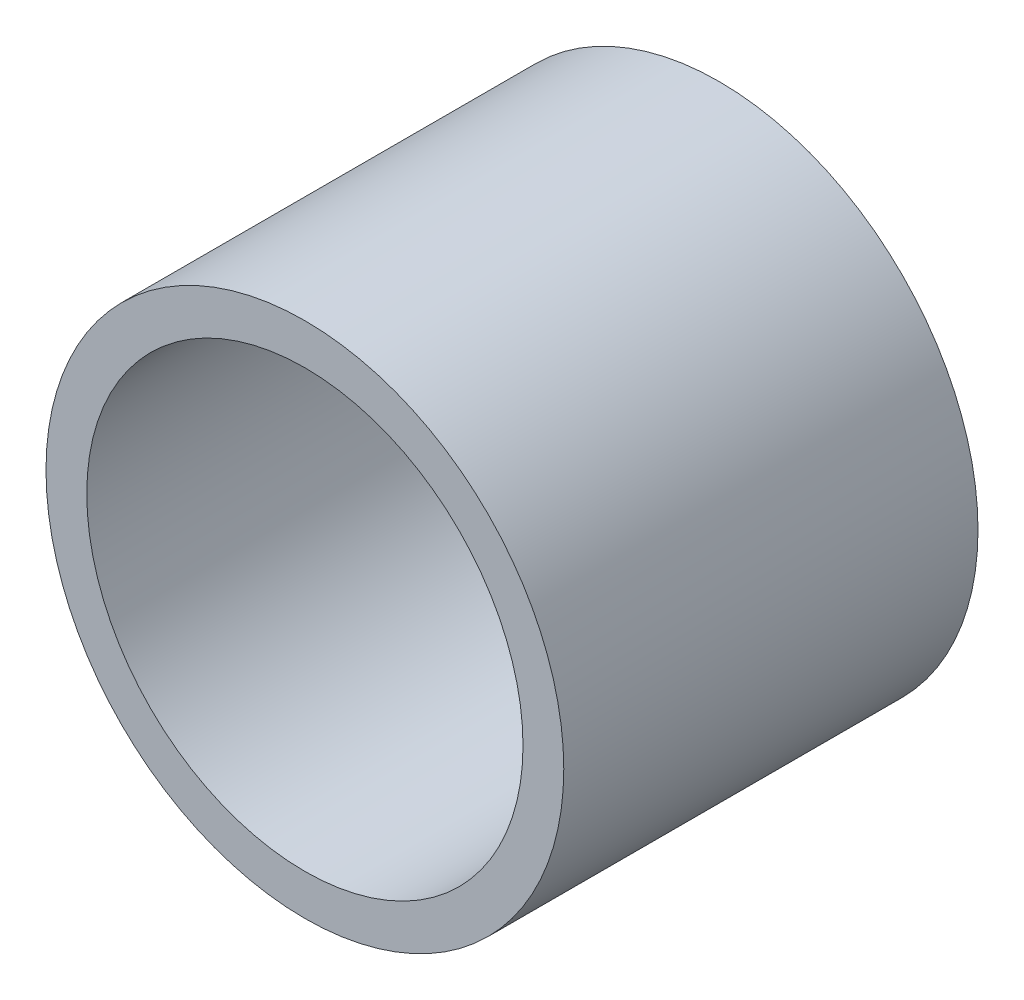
SolidWorks part; units mm, degrees
ref_plane "Front Plane" through (0, 0, 0) normal (0, 0, 1) x (1, 0, 0)
ref_plane "Top Plane" through (0, 0, 0) normal (0, 1, 0) x (1, 0, 0)
ref_plane "Right Plane" through (0, 0, 0) normal (1, 0, 0) x (0, 0, -1)
sketch "Sketch1" plane through (0, 0, 0) normal (0, 0, 1) x (1, 0, 0)
  circle A0 centre (0, 0) radius 15.875
  dimension "D1" = 31.75
extrude "Extrude-Thin1" add sketch "Sketch1" along normal blind 25.4 thin
